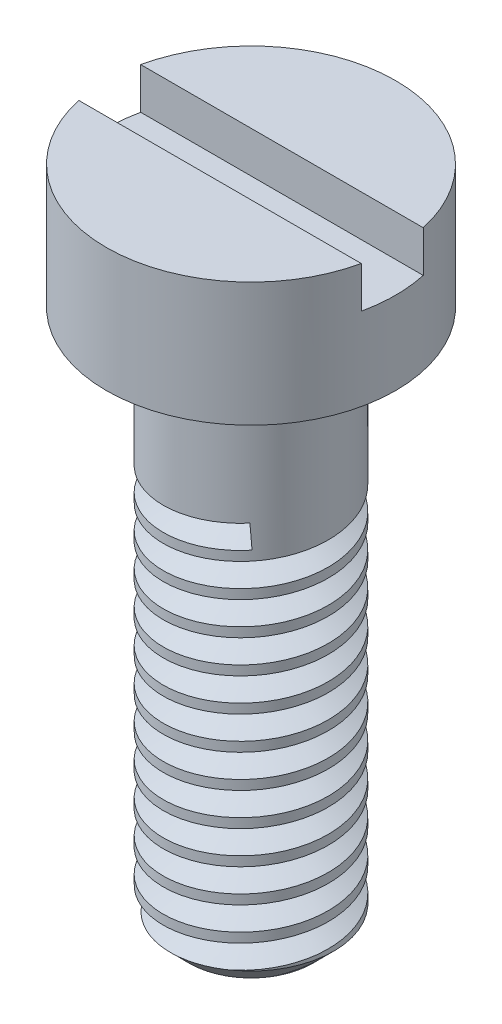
SolidWorks part; units mm, degrees
ref_plane "Plan de face" through (0, 0, 0) normal (0, 0, 1) x (1, 0, 0)
ref_plane "Plan de dessus" through (0, 0, 0) normal (0, 1, 0) x (1, 0, 0)
ref_plane "Plan de droite" through (0, 0, 0) normal (1, 0, 0) x (0, 0, -1)
sketch "Esquisse1" plane through (0, 0, 0) normal (0, 0, 1) x (1, 0, 0)
  line L0 (0, 0) -> (0, 8)
  line L1 (0, 8) -> (1.75, 8)
  line L2 (1.75, 8) -> (1.75, 6.5)
  line L3 (1.75, 6.5) -> (1, 6.5)
  line L4 (1, 6.5) -> (1, 0)
  line L5 (1, 0) -> (0, 0)
  dimension "D1" = 1
  dimension "D2" = 8
  dimension "D3" = 1.5
  dimension "D4" = 1.75
revolve "Révolution1" add sketch "Esquisse1" angle 360 about L0
chamfer "Chanfrein1" distance 0.25 angle 45 1 edges at (0, 0, -1)
sketch "Esquisse2" plane through (0, 0, 0) normal (1, 0, 0) x (0, 0, -1)
  line L0 (1.75, 8) -> (-1.75, 8) construction
  line L1 (-0.375, 8) -> (0.375, 8)
  line L2 (-0.375, 8) -> (-0.375, 7.5)
  line L3 (-0.375, 7.5) -> (0.375, 7.5)
  line L4 (0.375, 8) -> (0.375, 7.5)
  point P6 (0, 7.5)
  dimension "D1" = 0.75
  dimension "D2" = 0.5
extrude "Enlèv. mat.-Extru.1" cut sketch "Esquisse2" against normal through all both and the other way through all
sketch "Esquisse3" plane through (0, 0, 0) normal (0, -1, 0) x (1, 0, 0)
  circle A0 centre (0, 0) radius 1 construction
  circle A1 centre (0, 0) radius 1
curve "Hélice/Spirale1"
sketch3d "Esquisse3D1"
  spline S0 degree 3 number of poles 195 (0.7071, 0, 0.7071) -> (0.7071, 4.8, 0.7071) construction
  spline S1 degree 3 number of poles 195 (0.7071, 0, 0.7071) -> (0.7071, 4.8, 0.7071)
ref_plane "Plan1" through (0.7071, 0, 0.7071) normal (0.7057, 0.0635, -0.7057) x (-0.7028, -0.0633, -0.7085)
sketch "Esquisse4" plane through (0.7071, 0, 0.7071) normal (0.7057, 0.0635, -0.7057) x (-0.7028, -0.0633, -0.7085)
  line L0 (0, -0.1443) -> (0, 0.1443) construction
  line L1 (0, 0.1443) -> (0.25, 0)
  line L2 (0.25, 0) -> (0, -0.1443)
  line L3 (0, 0.1443) -> (-0.2267, 0.1443)
  line L4 (-0.2267, 0.1443) -> (-0.2267, -0.1443)
  line L5 (-0.2267, -0.1443) -> (0, -0.1443)
  point P4 (0, 0)
  dimension "D1" = 0.25
  dimension "D2" = 60
sweep "Enlèvement de matière-Balayage1" cut profiles "Esquisse4" path "Esquisse3D1"
